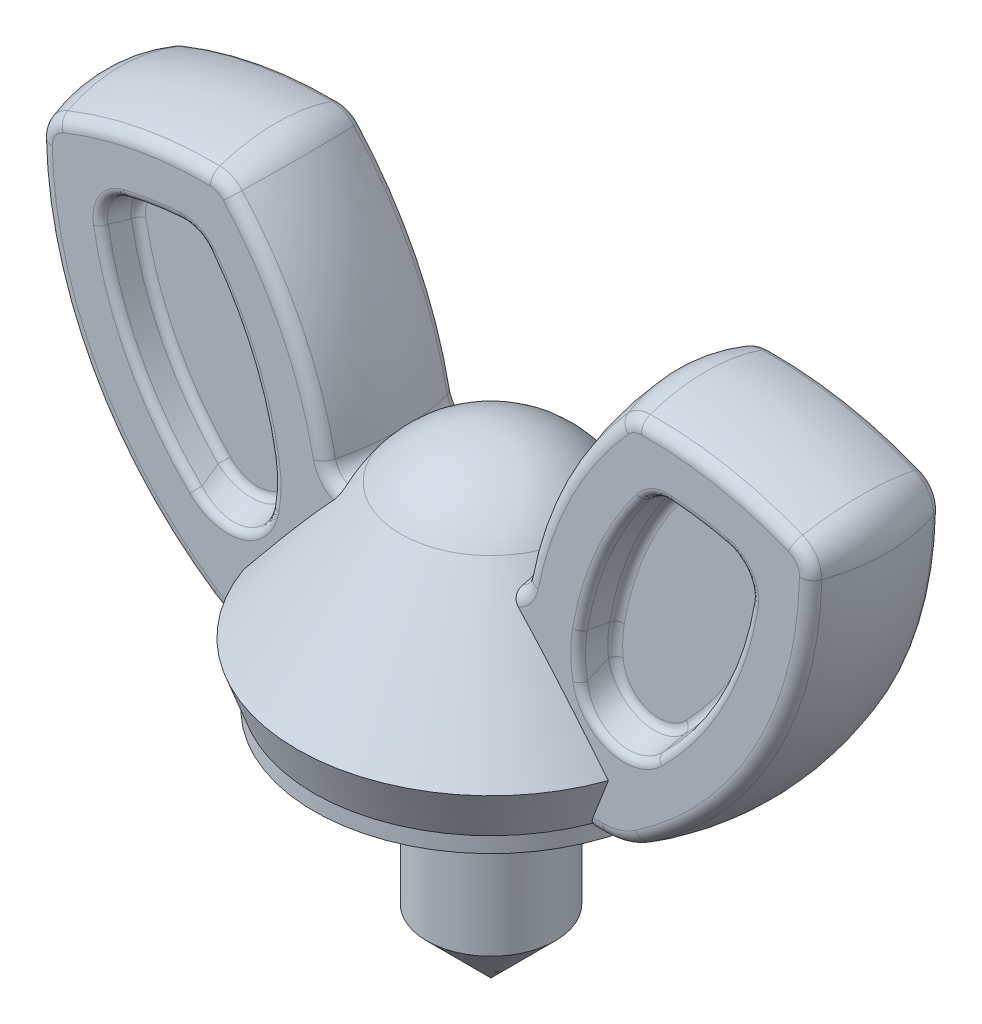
SolidWorks part; units mm, degrees
ref_plane "Front Plane" through (0, 0, 0) normal (0, 0, 1) x (1, 0, 0)
ref_plane "Top Plane" through (0, 0, 0) normal (0, 1, 0) x (1, 0, 0)
ref_plane "Right Plane" through (0, 0, 0) normal (1, 0, 0) x (0, 0, -1)
sketch "Sketch1" plane through (0, 0, 0) normal (0, 0, 1) x (1, 0, 0)
  line L0 (0, 10.7344) -> (0, 0) construction
  line L5 (4.826, 0) -> (-4.826, 0)
  line L6 (2.413, 5.08) -> (-2.413, 5.08)
  arc A11 (-2.413, 5.08) -> (-5.3975, 10.9034) centre (-13.1787, 3.2391) ccw
  arc A13 (-5.3975, 10.9034) -> (-10.795, 9.8298) centre (-6.0342, 0) ccw
  arc A24 (-10.795, 9.8298) -> (-6.0486, 0.3742) centre (0, 9.3295) ccw
  arc A26 (-4.826, 0) -> (-6.0486, 0.3742) centre (-4.826, 2.1844) cw
  arc A29 (4.826, 0) -> (6.0486, 0.3742) centre (4.826, 2.1844) ccw
  arc A34 (10.795, 9.8298) -> (6.0486, 0.3742) centre (0, 9.3295) cw
  arc A36 (5.3975, 10.9034) -> (10.795, 9.8298) centre (6.0342, 0) cw
  arc A37 (2.413, 5.08) -> (5.3975, 10.9034) centre (13.1787, 3.2391) cw
  point P19 (0, 0)
  point P27 (0, 5.08)
  point P29 (0, 5.08)
  point P44 (0, 5.08)
extrude "Extrude1" add sketch "Sketch1" along normal mid plane 3.556
fillet "Fillet4" radius 1.0922 4 edges at (10.795, 9.8298, 0) (5.3975, 10.9034, 0) (-5.3975, 10.9034, 0) (-10.795, 9.8298, 0)
sketch "Sketch2" plane through (0, 0, 1.778) normal (0, 0, 1) x (1, 0, 0)
  line L0 (0, 0) -> (0, 12.8329) construction
  line L1 (-4.826, 0) -> (4.826, 0) construction
  arc A10 (-4.1864, 4.7767) -> (-5.0416, 1.8652) centre (-7.5893, 4.1949) cw
  arc A11 (4.1864, 4.7767) -> (6.2055, 9.1212) centre (13.1787, 3.2391) cw
  arc A12 (6.2055, 9.1212) -> (8.9805, 8.634) centre (6.0342, 0) cw
  arc A13 (8.9805, 8.634) -> (5.0416, 1.8652) centre (0, 9.3295) cw
  arc A14 (4.1864, 4.7767) -> (5.0416, 1.8652) centre (7.5893, 4.1949) ccw
  arc A15 (-8.9805, 8.634) -> (-5.0416, 1.8652) centre (0, 9.3295) ccw
  arc A16 (-6.2055, 9.1212) -> (-8.9805, 8.634) centre (-6.0342, 0) ccw
  arc A17 (-4.1864, 4.7767) -> (-6.2055, 9.1212) centre (-13.1787, 3.2391) ccw
  arc A18 (-8.9805, 8.634) -> (-5.0416, 1.8652) centre (0, 9.3295) ccw
  arc A19 (-6.2055, 9.1212) -> (-8.9805, 8.634) centre (-6.0342, 0) ccw
  arc A20 (-4.1864, 4.7767) -> (-6.2055, 9.1212) centre (-13.1787, 3.2391) ccw
extrude "Cut-Extrude1" cut sketch "Sketch2" against normal blind 0.889 draft 10
fillet "Fillet1" radius 0.889 4 edges
fillet "Fillet6" radius 1.2446 2 edges
fillet "Fillet5" radius 0.3641 2 edges at (2.413, 5.08, 0) (-2.413, 5.08, 0)
fillet "Fillet3" radius 0.2223 28 edges at (7.4585, 9.011, 1.778) (7.4007, 8.8613, 0.889) (6.4621, 8.9114, 0.889) (8.6146, 8.3041, 0.889) (7.8855, 5.3103, 0.889) (4.2988, 4.3764, 0.889) (6.1282, 8.9579, 1.778) (8.7221, 8.5339, 1.778) (7.9776, 5.1471, 1.778) (4.1377, 4.1292, 1.778) (-4.2988, 4.3764, 0.889) (-7.8855, 5.3103, 0.889) (-8.5332, 8.4279, 0.889) (-7.4007, 8.8613, 0.889) (-6.1942, 8.7899, 0.889) (-4.1377, 4.1292, 1.778) (-7.9776, 5.1471, 1.778) (-8.7866, 8.4358, 1.778) (-7.4585, 9.011, 1.778) (-6.3795, 9.0717, 1.778) (4.9351, 6.7652, 0.889) (4.81, 6.8709, 1.778) (-4.9351, 6.7652, 0.889) (-4.81, 6.8709, 1.778) (4.9742, 2.938, 0.889) (5.0791, 2.5366, 1.778) (-5.2102, 2.8514, 0.889) (-5.0131, 2.5568, 1.778)
mirror "Mirror1" about plane through (0, 0, 0) normal (0, 0, 1) of "Fillet6", "Fillet3", "Fillet1", "Cut-Extrude1"
sketch "Sketch4" plane through (0, 0, 0) normal (1, 0, 0) x (0, 0, -1)
  line L1 (-1.778, 5.334) -> (1.778, 5.334)
  line L2 (-1.778, 4.4704) -> (-1.778, 5.334)
  line L4 (1.778, 0.3742) -> (1.778, 9.0918) construction
  line L6 (-1.778, 9.0918) -> (-1.778, 0.3742) construction
  line L7 (0, 5.715) -> (0, 0.381) construction
  line L9 (1.778, 4.4704) -> (1.778, 5.334)
  line L10 (-1.778, 5.08) -> (1.778, 5.08) construction
  arc A0 (-1.524, 4.826) -> (-1.778, 4.4704) centre (-1.4021, 4.4704) ccw
  arc A1 (1.524, 4.826) -> (-1.524, 4.826) centre (0, 0.381) ccw
  arc A2 (1.524, 4.826) -> (1.778, 4.4704) centre (1.4021, 4.4704) cw
  point P8 (0, 5.08)
sketch3d "3DSketch1"
  line L2 (-2.1102, 5.08, 1.778) -> (2.1102, 5.08, 1.778)
  line L3 (4.826, 0, 1.778) -> (-4.826, 0, 1.778)
  line L4 (-2.1102, 5.08, 1.778) -> (2.1102, 5.08, 1.778)
  line L5 (4.826, 0, 1.778) -> (-4.826, 0, 1.778)
  arc A15 (10.804, 9.0918, 1.778) -> (6.0486, 0.3742, 1.778) centre (0, 9.3295, 1.778) ccw
  arc A16 (10.1207, 10.1287, 1.778) -> (10.804, 9.0918, 1.778) centre (9.712, 9.1158, 1.778) ccw
  arc A17 (5.8682, 10.9207, 1.778) -> (10.1207, 10.1287, 1.778) centre (6.0342, 0, 1.778) ccw
  arc A18 (5.0743, 10.5608, 1.778) -> (5.8682, 10.9207, 1.778) centre (5.8848, 9.8287, 1.778) ccw
  arc A19 (2.4672, 5.3729, 1.778) -> (5.0743, 10.5608, 1.778) centre (13.1787, 3.2391, 1.778) ccw
  arc A20 (2.1102, 5.08, 1.778) -> (2.4672, 5.3729, 1.778) centre (2.1102, 5.4441, 1.778) ccw
  arc A21 (2.1102, 5.08, 1.778) -> (2.4672, 5.3729, 1.778) centre (2.1102, 5.4441, 1.778) ccw
  arc A22 (-5.0743, 10.5608, 1.778) -> (-2.4672, 5.3729, 1.778) centre (-13.1787, 3.2391, 1.778) ccw
  arc A23 (-5.8682, 10.9207, 1.778) -> (-5.0743, 10.5608, 1.778) centre (-5.8848, 9.8287, 1.778) ccw
  arc A24 (-10.1207, 10.1287, 1.778) -> (-5.8682, 10.9207, 1.778) centre (-6.0342, 0, 1.778) ccw
  arc A25 (-10.804, 9.0918, 1.778) -> (-10.1207, 10.1287, 1.778) centre (-9.712, 9.1158, 1.778) ccw
  arc A26 (-6.0486, 0.3742, 1.778) -> (-10.804, 9.0918, 1.778) centre (0, 9.3295, 1.778) ccw
  arc A27 (-4.826, 0, 1.778) -> (-6.0486, 0.3742, 1.778) centre (-4.826, 2.1844, 1.778) ccw
  arc A28 (6.0486, 0.3742, 1.778) -> (4.826, 0, 1.778) centre (4.826, 2.1844, 1.778) ccw
  arc A29 (10.804, 9.0918, 1.778) -> (6.0486, 0.3742, 1.778) centre (0, 9.3295, 1.778) ccw
  arc A30 (10.1207, 10.1287, 1.778) -> (10.804, 9.0918, 1.778) centre (9.712, 9.1158, 1.778) ccw
  arc A31 (5.8682, 10.9207, 1.778) -> (10.1207, 10.1287, 1.778) centre (6.0342, 0, 1.778) ccw
  arc A32 (5.0743, 10.5608, 1.778) -> (5.8682, 10.9207, 1.778) centre (5.8848, 9.8287, 1.778) ccw
  arc A33 (2.4672, 5.3729, 1.778) -> (5.0743, 10.5608, 1.778) centre (13.1787, 3.2391, 1.778) ccw
  arc A34 (-2.4672, 5.3729, 1.778) -> (-2.1102, 5.08, 1.778) centre (-2.1102, 5.4441, 1.778) ccw
  arc A35 (-2.4672, 5.3729, 1.778) -> (-2.1102, 5.08, 1.778) centre (-2.1102, 5.4441, 1.778) ccw
  arc A36 (-5.0743, 10.5608, 1.778) -> (-2.4672, 5.3729, 1.778) centre (-13.1787, 3.2391, 1.778) ccw
  arc A37 (-5.8682, 10.9207, 1.778) -> (-5.0743, 10.5608, 1.778) centre (-5.8848, 9.8287, 1.778) ccw
  arc A38 (-10.1207, 10.1287, 1.778) -> (-5.8682, 10.9207, 1.778) centre (-6.0342, 0, 1.778) ccw
  arc A39 (-10.804, 9.0918, 1.778) -> (-10.1207, 10.1287, 1.778) centre (-9.712, 9.1158, 1.778) ccw
  arc A40 (-6.0486, 0.3742, 1.778) -> (-10.804, 9.0918, 1.778) centre (0, 9.3295, 1.778) ccw
  arc A41 (-4.826, 0, 1.778) -> (-6.0486, 0.3742, 1.778) centre (-4.826, 2.1844, 1.778) ccw
  arc A42 (6.0486, 0.3742, 1.778) -> (4.826, 0, 1.778) centre (4.826, 2.1844, 1.778) ccw
  point P3 (2.1102, 5.4441, 2.1421)
  point P5 (2.1102, 5.4441, 2.1421)
  point P11 (-2.1102, 5.4441, 2.1421)
  point P13 (-2.1102, 5.4441, 2.1421)
  point P43 (0, 9.3295, -9.0286)
  point P46 (9.712, 9.1158, 0.6858)
  point P48 (6.0342, 0, -9.144)
  point P50 (5.8848, 9.8287, 0.6858)
  point P52 (13.1787, 3.2391, -9.144)
  point P58 (-13.1787, 3.2391, -9.144)
  point P60 (-5.8848, 9.8287, 0.6858)
  point P62 (-6.0342, 0, -9.144)
  point P64 (-9.712, 9.1158, 0.6858)
  point P66 (0, 9.3295, -9.0286)
  point P68 (-4.826, 2.1844, -0.4064)
  point P70 (4.826, 2.1844, -0.4064)
  point P71 (0, 9.3295, -9.0286)
  point P72 (9.712, 9.1158, 0.6858)
  point P73 (6.0342, 0, -9.144)
  point P74 (5.8848, 9.8287, 0.6858)
  point P75 (13.1787, 3.2391, -9.144)
  point P78 (-13.1787, 3.2391, -9.144)
  point P79 (-5.8848, 9.8287, 0.6858)
  point P80 (-6.0342, 0, -9.144)
  point P81 (-9.712, 9.1158, 0.6858)
  point P82 (0, 9.3295, -9.0286)
  point P83 (-4.826, 2.1844, -0.4064)
  point P84 (4.826, 2.1844, -0.4064)
  dimension "D1" = 0
sweep "Cut-Sweep2" cut profiles "Sketch4" path "3DSketch1"
sketch "Sketch3" plane through (0, 0, 0) normal (0, 0, 1) x (1, 0, 0)
  line L0 (0, 6.5903) -> (0, -11.3525) construction
  line L1 (1.7526, 0) -> (4.826, 0)
  line L2 (5.2882, 1.6933) -> (2.4672, 5.3729)
  line L4 (1.7526, 0) -> (1.7526, -6.35)
  line L5 (1.7526, -6.35) -> (0, -6.35)
  line L6 (4.826, 0) -> (4.826, 0.4233)
  line L7 (0, 6.5903) -> (0, -6.35)
  line L8 (0, 6.5903) -> (-2.4754, 6.5903) construction
  line L9 (4.826, 0.4233) -> (5.2882, 1.6933)
  arc A1 (2.4672, 5.3729) -> (0, 6.5903) centre (0, 3.4814) ccw
revolve "Revolve1" add sketch "Sketch3" angle 360 about L0
sketch "Sketch6" plane through (0, 0, 0) normal (0, 0, 1) x (1, 0, 0)
  line L0 (0, 4.5862) -> (0, -8.2597) construction
  line L1 (0, -6.35) -> (2.0066, -4.3434)
  line L2 (-1.7526, -6.35) -> (1.7526, -6.35) construction
  line L3 (2.0066, -4.3434) -> (2.0066, -6.604)
  line L4 (2.0066, -6.604) -> (0, -6.604)
  line L5 (0, -6.604) -> (0, -6.35)
  line L8 (1.7526, -6.35) -> (1.7526, 0) construction
  dimension "D1" = 135
  dimension "D2" = 0.254
  dimension "D3" = 0.254
revolve "Cut-Revolve11" cut sketch "Sketch6" angle 360 about L0
sketch "Sketch5" plane through (0, 0, 0) normal (0, 0, 1) x (1, 0, 0)
  line L0 (1.7526, -0.0254) -> (1.2802, -0.2982)
  line L1 (1.2802, -0.2982) -> (1.7526, -0.5709)
  line L2 (1.7526, -0.5709) -> (1.7526, -0.0254)
  line L3 (0, 0) -> (0, -7.7715) construction
  line L6 (1.2802, -0.2982) -> (1.2802, -1.0906) construction
revolve "Cut-Revolve10" [suppressed] cut sketch "Sketch5" angle 360 about L3
pattern_linear "LPattern10" [suppressed] count 8 spacing 0.7925 along (0, -1, 0)
equation "\"D5@Sketch1\" = \"E@Sketch1\" / 2"
equation "\"D1@Sketch1\" = \"A@Sketch1\" / 4"
equation "\"D3@Sketch1\" = \"B@Sketch1\" * 9 /  10"
equation "\"D4@Sketch1\" = \"B@Sketch1\""
equation "\"D2@Sketch1\" = \"D4@Sketch1\" / 5"
equation "\"D1@Cut-Extrude1\" = \"C@Extrude1\" / 4"
equation "\"D1@Fillet1\" = \"D1@Cut-Extrude1\""
equation "\"D1@Fillet3\" = \"D1@Cut-Extrude1\" / 4"
equation "\"D2@Sketch3\" = \"G@Sketch1\" / 4"
equation "\"D3@Sketch3\" = \"E@Sketch1\""
equation "\"D1@Sketch4\" = \"C@Extrude1\" / 14"
equation "\"D1@Sketch5\" = \"d1@Sketch3\""
equation "\"D2@Sketch5\" = \"THD_MINOR@Cosmetic Thread1\""
equation "\"D3@LPattern10\" = \"pitch@Sketch5\""
equation "\"D1@LPattern10\" = \"L@Sketch3\" / \"D3@LPattern10\""
equation "\"D1@Cosmetic Thread1\" = \"L@Sketch3\""
equation "\"D2@Sketch4\" = \"D1@Sketch4\""
equation "\"D4@Sketch3\" = \"D2@Sketch3\" / 3"
equation "\"D1@Fillet4\" = \"D2@Sketch1\" /2"
equation "\"D1@Sketch2\" = \"D1@Sketch1\" / 3"
equation "\"D1@Fillet5\" = \"D1@Fillet4\" / 3"
equation "\"D1@Fillet6\" = \"D1@Fillet1\" * 1.4"
